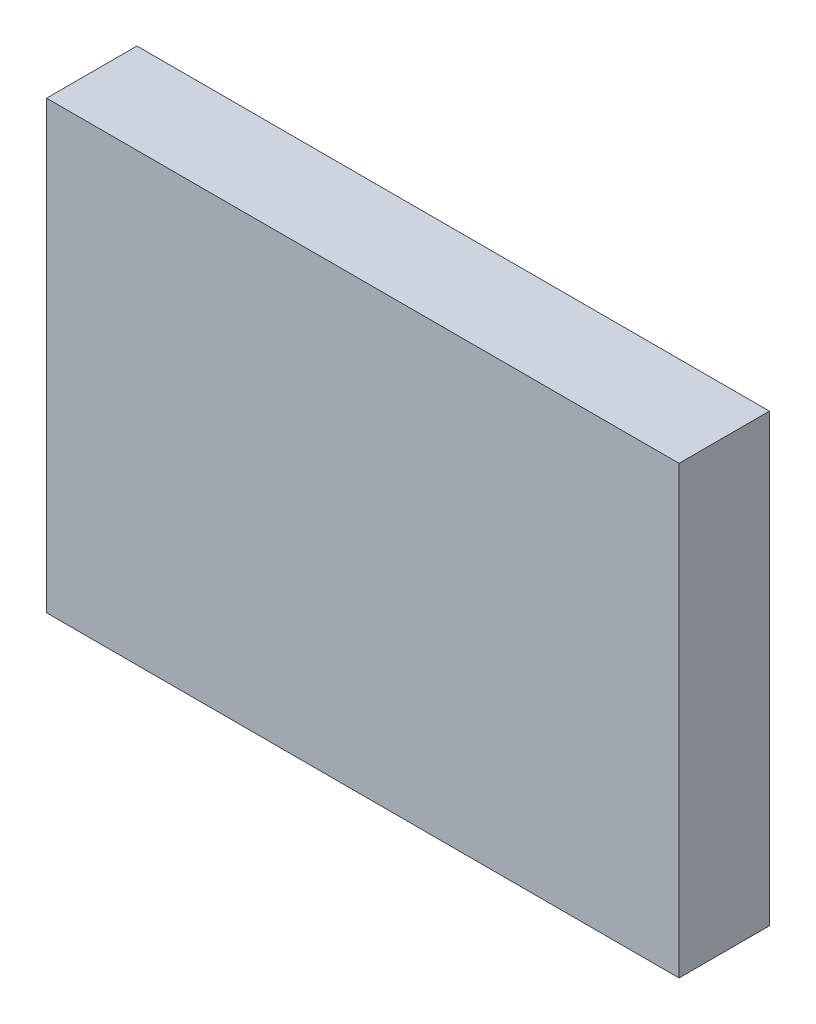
SolidWorks part; units mm, degrees
ref_plane "Plan de face" through (0, 0, 0) normal (0, 0, 1) x (1, 0, 0)
ref_plane "Plan de dessus" through (0, 0, 0) normal (0, 1, 0) x (1, 0, 0)
ref_plane "Plan de droite" through (0, 0, 0) normal (1, 0, 0) x (0, 0, -1)
sketch "Esquisse1" plane through (0, 0, 0) normal (0, 0, 1) x (1, 0, 0)
  line L1 (0, 0) -> (210, 0)
  line L2 (0, 0) -> (0, 148)
  line L3 (0, 148) -> (210, 148)
  line L4 (210, 0) -> (210, 148)
  dimension "D1" = 148
  dimension "D2" = 210
extrude "Boss.-Extru.1" add sketch "Esquisse1" along normal blind 30
